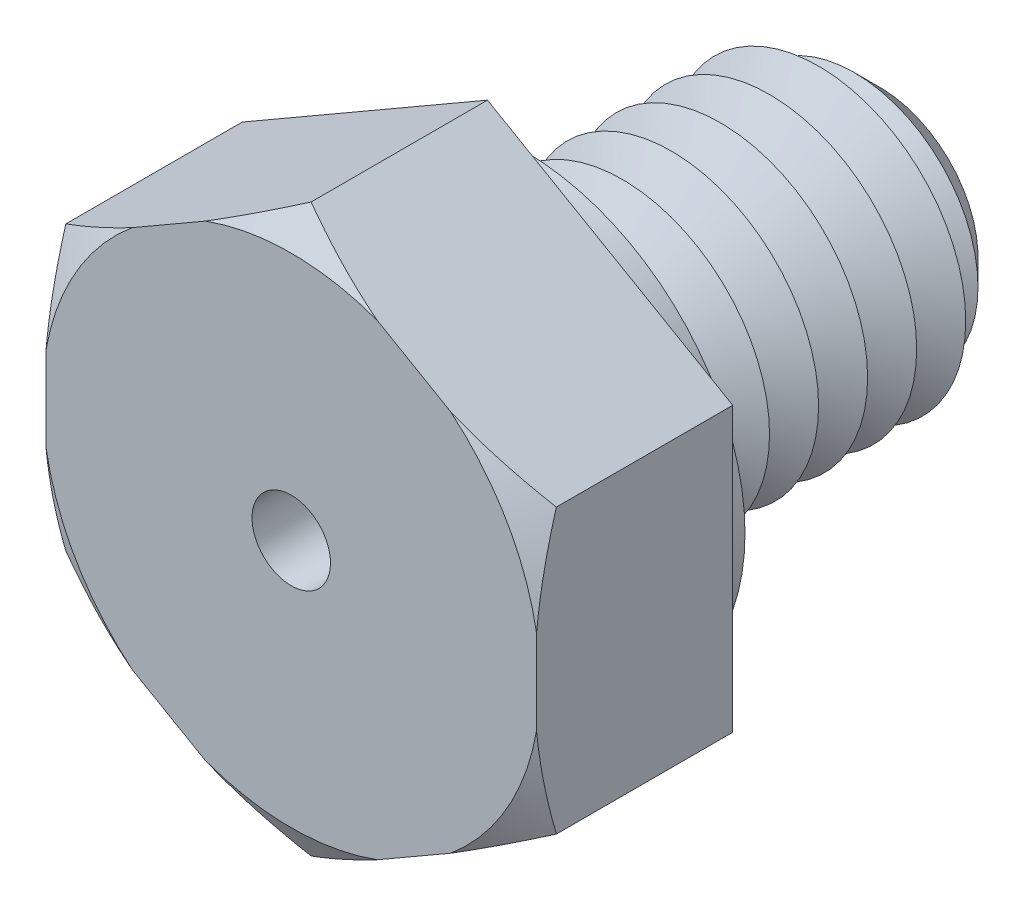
SolidWorks part; units mm, degrees
ref_plane "Front Plane" through (0, 0, 0) normal (0, 0, 1) x (1, 0, 0)
ref_plane "Top Plane" through (0, 0, 0) normal (0, 1, 0) x (1, 0, 0)
ref_plane "Right Plane" through (0, 0, 0) normal (1, 0, 0) x (0, 0, -1)
sketch "Sketch2" plane through (0, 0, 0) normal (0, 0, 1) x (1, 0, 0)
  line L1 (0, 5.7735) -> (-5, 2.8868)
  line L2 (-5, 2.8868) -> (-5, -2.8868)
  line L3 (-5, -2.8868) -> (0, -5.7735)
  line L4 (0, -5.7735) -> (5, -2.8868)
  line L5 (5, -2.8868) -> (5, 2.8868)
  line L6 (5, 2.8868) -> (0, 5.7735)
  circle A0 centre (0, 0) radius 5 construction
  dimension "D1" = 10
extrude "Boss-Extrude1" add sketch "Sketch2" along normal blind 4
sketch "Sketch3" plane through (0, 0, 0) normal (0, 0, -1) x (-1, 0, 0)
  circle A0 centre (0, 0) radius 3
  dimension "D1" = 6
extrude "Boss-Extrude2" add sketch "Sketch3" along normal blind 8
sketch "Sketch4" plane through (0, 0, 0) normal (0, 0, -1) x (-1, 0, 0)
  circle A0 centre (0, 0) radius 4.5
  dimension "D1" = 9
extrude "Boss-Extrude3" add sketch "Sketch4" along normal blind 0.75
sketch "Sketch5" plane through (0, 0, 0) normal (1, 0, 0) x (0, 0, -1)
  line L0 (-3.2117, 0) -> (6.3192, 0) construction
chamfer "Chamfer1" distance 1 angle 45 1 edges at (-3, 0, -8)
sketch "Sketch6" plane through (0, 0, 0) normal (1, 0, 0) x (0, 0, -1)
  line L0 (0.75, 3) -> (1.25, 2.134)
  line L1 (1.25, 2.134) -> (1.75, 3)
  line L2 (7, 3) -> (0.75, 3) construction
  line L3 (1.75, 3) -> (0.75, 3)
  dimension "D1" = 1
revolve "Cut-Revolve1" cut sketch "Sketch6" angle 360 about L0
pattern_linear "LPattern1" count 7 spacing 1 along (0, 0, -1) of "Cut-Revolve1"
sketch "Sketch7" plane through (0, 0, 0) normal (1, 0, 0) x (0, 0, -1)
  line L0 (-4, 5.7735) -> (-4, 5.0735)
  line L1 (-4, 2.8868) -> (-4, 5.7735) construction
  line L2 (-4, 5.0735) -> (-3.5959, 5.7735)
  line L3 (-4, 5.7735) -> (0, 5.7735) construction
  line L4 (-3.5959, 5.7735) -> (-4, 5.7735)
  dimension "D1" = 0.7
  dimension "D2" = 30
revolve "Cut-Revolve2" cut sketch "Sketch7" angle 360 about L0
sketch "Sketch8" plane through (0, 0, 4) normal (0, 0, 1) x (1, 0, 0)
  circle A0 centre (0, 0) radius 0.8
  dimension "D1" = 1.6
extrude "Cut-Extrude1" cut sketch "Sketch8" against normal up to surface (12 mm away)
